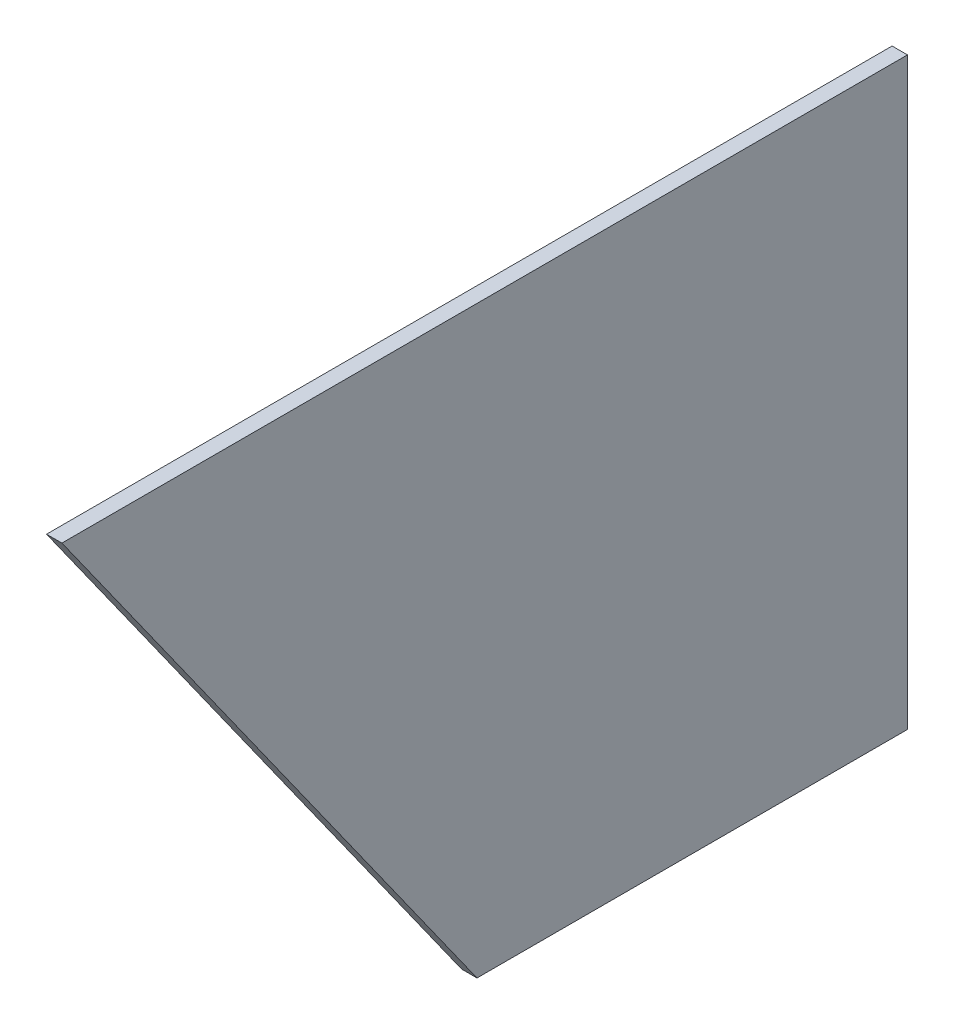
SolidWorks part; units mm, degrees
ref_plane "Alzado" through (0, 0, 0) normal (0, 0, 1) x (1, 0, 0)
ref_plane "Planta" through (0, 0, 0) normal (0, 1, 0) x (1, 0, 0)
ref_plane "Vista lateral" through (0, 0, 0) normal (1, 0, 0) x (0, 0, -1)
sketch "Sketch1" plane through (0, 0, 0) normal (1, 0, 0) x (0, 0, -1)
  line L0 (-165, 114) -> (-84, 0)
  line L1 (-84, 0) -> (0, 0)
  line L3 (-165, 114) -> (0, 114)
  line L4 (0, 0) -> (0, 114)
  point P0 (0, 0)
  point P4 (0, 0)
  point P5 (0, 0)
  dimension "D1" = 114
  dimension "D2" = 84
  dimension "D3" = 165
extrude "Boss-Extrude1" add sketch "Sketch1" along normal blind 3
